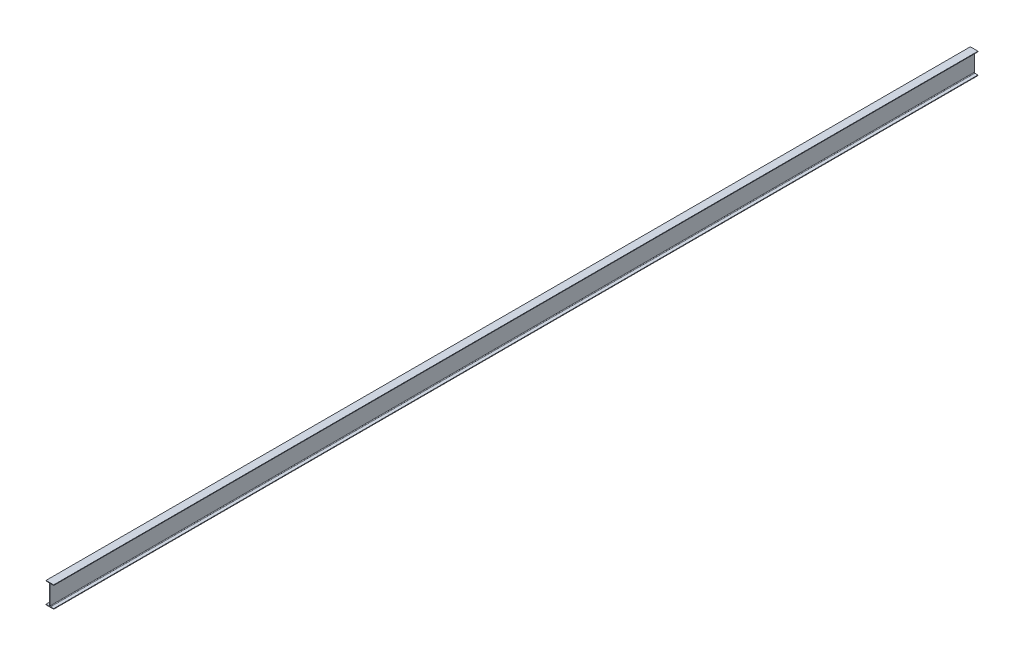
SolidWorks part; units mm, degrees
ref_plane "Front Plane" through (0, 0, 0) normal (0, 0, 1) x (1, 0, 0)
ref_plane "Top Plane" through (0, 0, 0) normal (0, 1, 0) x (1, 0, 0)
ref_plane "Right Plane" through (0, 0, 0) normal (1, 0, 0) x (0, 0, -1)
sketch "Sketch1" plane through (0, 0, 0) normal (0, 0, 1) x (1, 0, 0)
  line B0 (-63.5, -174.498) -> (-63.5, -165.989)
  line B1 (-63.5, -165.989) -> (-13.081, -165.989)
  line B2 (-2.921, -155.829) -> (-2.921, 155.829)
  line B3 (-13.081, 165.989) -> (-63.5, 165.989)
  line B4 (-63.5, 165.989) -> (-63.5, 174.498)
  line B5 (-63.5, 174.498) -> (63.5, 174.498)
  line B6 (63.5, 174.498) -> (63.5, 165.989)
  line B7 (63.5, 165.989) -> (13.081, 165.989)
  line B8 (2.921, 155.829) -> (2.921, -155.829)
  line B9 (13.081, -165.989) -> (63.5, -165.989)
  line B10 (63.5, -165.989) -> (63.5, -174.498)
  line B11 (63.5, -174.498) -> (-63.5, -174.498)
  line B12 (0, -174.498) -> (0, 174.498) construction
  arc B13 (-13.081, -165.989) -> (-2.921, -155.829) centre (-13.081, -155.829) ccw
  arc B14 (-2.921, 155.829) -> (-13.081, 165.989) centre (-13.081, 155.829) ccw
  arc B15 (13.081, 165.989) -> (2.921, 155.829) centre (13.081, 155.829) ccw
  arc B16 (2.921, -155.829) -> (13.081, -165.989) centre (13.081, -155.829) ccw
sketch_block_instance "w14x22-1"
sketch_block "w14x22"
extrude "Boss-Extrude1" add sketch "Sketch1" along normal mid plane 15265.4
